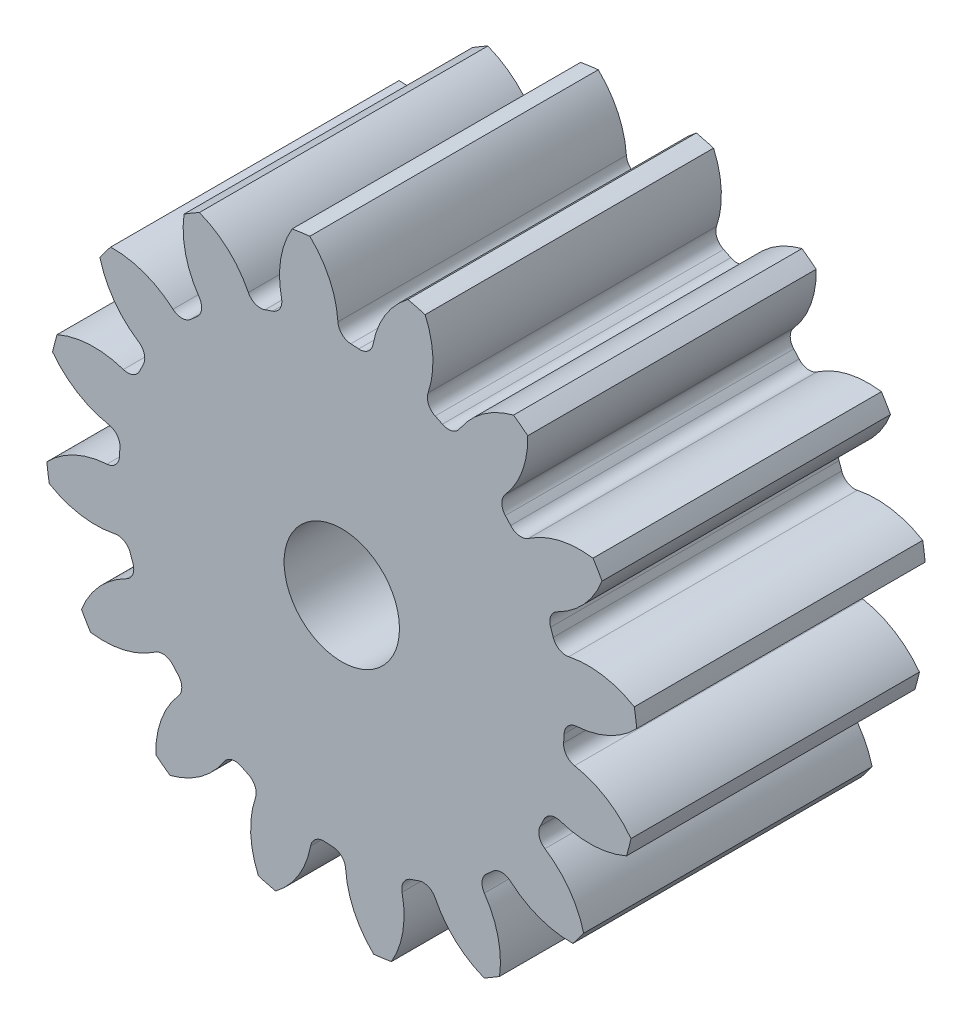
SolidWorks part; units mm, degrees
ref_plane "Front" through (0, 0, 0) normal (0, 0, 1) x (1, 0, 0)
ref_plane "Top" through (0, 0, 0) normal (0, 1, 0) x (1, 0, 0)
ref_plane "Right" through (0, 0, 0) normal (1, 0, 0) x (0, 0, -1)
sketch "Sketch3" plane through (0, 0, 0) normal (0, 0, 1) x (1, 0, 0)
  circle A0 centre (0, 0) radius 91.44
  dimension "od" = 182.88
extrude "gearBody" add sketch "Sketch3" along normal blind 88.9
sketch "Sketch2" plane through (0, 0, 0) normal (0, 0, 1) x (1, 0, 0)
  line L0 (0, 0) -> (70.5643, 29.2287) construction
  line L1 (89.6024, -21.0045) -> (0, 0) construction
  line L2 (0, 0) -> (36.3143, 0) construction
  line L3 (81.216, 3.2244) -> (80.2865, -12.6693) construction
  line L5 (80.7513, -4.7225) -> (0, 0) construction
  line L7 (0, 0) -> (76.3782, 0) construction
  arc A0 (76.3586, 1.7313) -> (75.6363, -10.6202) centre (0, 0) ccw construction
  arc A1 (90.9086, 9.8434) -> (89.1415, -20.373) centre (0, 0) ccw construction
  arc A2 (81.216, 3.2244) -> (80.2865, -12.6693) centre (0, 0) ccw construction
  arc A3 (68.38, -5.2337) -> (68.5239, -2.7726) centre (0, 0) ccw
  arc A4 (89.6024, -21.0045) -> (71.7556, -9.6163) centre (66.6762, -37.2547) ccw
  arc A5 (89.6024, -21.0045) -> (91.44, 10.4168) centre (0, 0) ccw
  arc A6 (91.44, 10.4168) -> (72.3874, 1.1866) centre (70.5643, 29.2287) cw
  arc A7 (68.5239, -2.7726) -> (72.3874, 1.1866) centre (72.6557, -2.9398) cw
  arc A8 (71.7556, -9.6163) -> (68.38, -5.2337) centre (72.5031, -5.5493) cw
  point P6 (91.44, 10.4168)
  point P22 (89.6024, -21.0045)
  dimension "baseDia" = 152.7564
  dimension "od" = 182.88
  dimension "pd" = 162.56
  dimension "rd" = 137.16
  dimension "rFillet" = 4.1351
  dimension "pointX" = 91.44
  dimension "pointY" = 10.4168
  dimension "CTT" = 15.8937
  dimension "flankCenterAngle" = 22.5
extrude "toothCut" cut sketch "Sketch2" along normal through all
pattern_circular "CirPattern1" count 16 over 360 about axis through (0, 0, 0) along (0, 0, 1) of "toothCut"
sketch "hub1Dia" plane through (0, 0, 0) normal (0, 0, -1) x (-1, 0, 0)
  circle A0 centre (0, 0) radius 12.7
  dimension "hub1Dia" = 25.4
sketch "hub2Dia" plane through (0, 0, 88.9) normal (0, 0, 1) x (1, 0, 0)
  circle A0 centre (0, 0) radius 12.7
  dimension "hub2dia" = 25.4
sketch "boreDia" plane through (0, 0, 0) normal (0, 0, 1) x (1, 0, 0)
  circle A0 centre (0, 0) radius 17.78
  dimension "boreDia" = 35.56
extrude "bore" cut sketch "boreDia" against normal mid plane 25400
